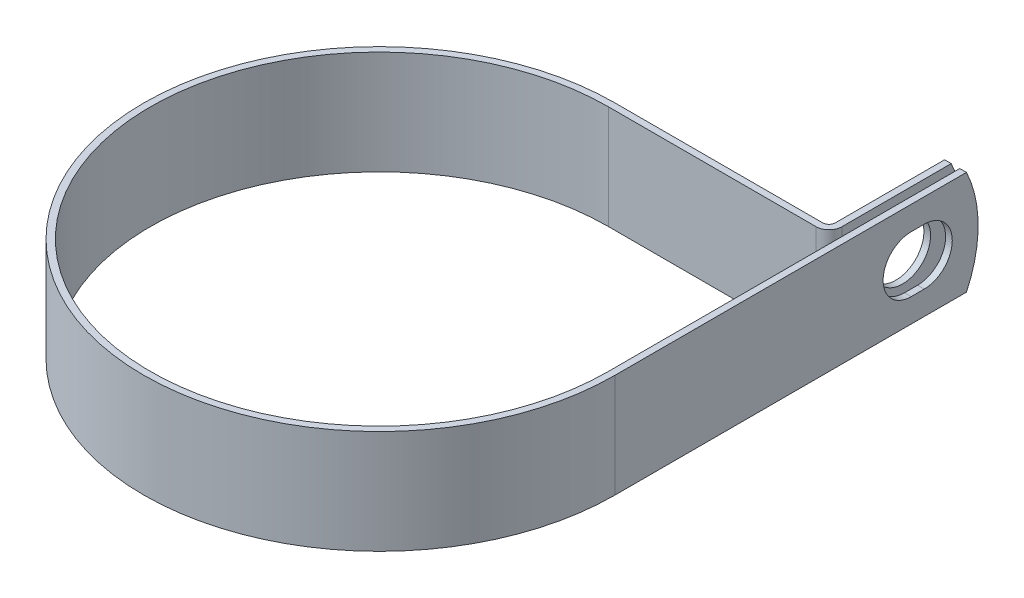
SolidWorks part; units mm, degrees
ref_plane "Front Plane" through (0, 0, 0) normal (0, 0, 1) x (1, 0, 0)
ref_plane "Top Plane" through (0, 0, 0) normal (0, 1, 0) x (1, 0, 0)
ref_plane "Right Plane" through (0, 0, 0) normal (1, 0, 0) x (0, 0, -1)
sketch "Sketch1" plane through (0, 0, 0) normal (0, 1, 0) x (1, 0, 0)
  line L0 (0, 42.0624) -> (38.1102, 42.0624)
  line L1 (42.0624, 0) -> (42.0624, 42.0624)
  line L2 (40.4876, 66.6496) -> (40.4876, 44.4398)
  line L5 (42.0624, 42.0624) -> (42.0624, 66.6496)
  arc A0 (0, 42.0624) -> (42.0624, 0) centre (0, 0) ccw
  arc A3 (38.1102, 42.0624) -> (40.4876, 44.4398) centre (38.1102, 44.4398) ccw
extrude "Extrude-Thin1" add sketch "Sketch1" along normal mid plane 19.05 thin
sketch "Sketch2" plane through (39.2684, 0, 0) normal (-1, 0, 0) x (0, 0, 1)
  line L0 (-66.6496, 9.525) -> (-66.6496, -9.525) construction
  line L7 (0, 9.525) -> (0, -9.525) construction
  circle A0 centre (-55.5498, 0) radius 5.1562
  point P2 (-66.6496, 0)
extrude "Cut-Extrude1" cut sketch "Sketch2" against normal up to surface (1.2192 mm away)
sketch "Sketch3" plane through (43.2816, 0, 0) normal (1, 0, 0) x (0, 0, -1)
  line L0 (54.356, 0) -> (56.7436, 0) construction
  line L1 (54.356, 5.1562) -> (56.7436, 5.1562)
  line L2 (54.356, -5.1562) -> (56.7436, -5.1562)
  line L3 (66.6496, 9.525) -> (66.6496, -9.525) construction
  arc A0 (54.356, 5.1562) -> (54.356, -5.1562) centre (54.356, 0) ccw
  arc A1 (56.7436, -5.1562) -> (56.7436, 5.1562) centre (56.7436, 0) ccw
  point P3 (55.5498, 0)
  point P8 (66.6496, 0)
  point P11 (49.1998, 0)
  point P12 (61.8998, 0)
extrude "Cut-Extrude2" cut sketch "Sketch3" against normal up to surface (1.2192 mm away)
sketch "Sketch4" plane through (39.2684, 0, 0) normal (-1, 0, 0) x (0, 0, 1)
  line L0 (-66.6496, 9.525) -> (-66.6496, -9.525)
  line L1 (-66.6496, 9.525) -> (-64.5051, 9.525)
  line L2 (-66.6496, 9.525) -> (-44.4398, 9.525) construction
  line L3 (-66.6496, -9.525) -> (-64.5051, -9.525)
  line L4 (-66.6496, -9.525) -> (-44.4398, -9.525) construction
  arc A0 (-64.5051, 9.525) -> (-64.5051, -9.525) centre (-44.4246, 0) ccw
extrude "Cut-Extrude3" cut sketch "Sketch4" against normal through all contours A0 M4 M5 | A0 L0 M2
equation "\"D1@Sketch3\" = \"D2@Sketch2\""
equation "\"D7@Sketch1\" = \"D3@Sketch2\" + \"D1@Sketch3\""
equation "\"D1@Sketch4\" = ( \"D1@Extrude-Thin1\" + .125 ) * 2"
equation "\"D2@Sketch1\"=1.95*\"D5@Extrude-Thin1\""
equation "\"D2@Sketch3\" = \"D1@Sketch2\""
